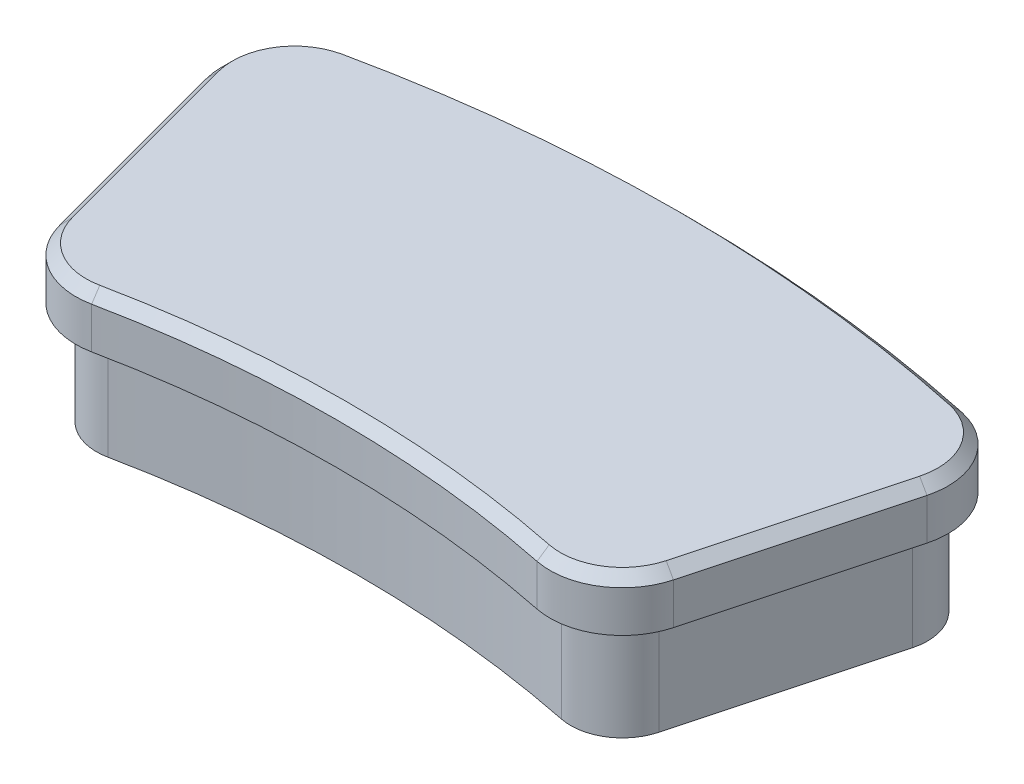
SolidWorks part; units mm, degrees
ref_plane "Front" through (0, 0, 0) normal (0, 0, 1) x (1, 0, 0)
ref_plane "Top" through (0, 0, 0) normal (0, 1, 0) x (1, 0, 0)
ref_plane "Right" through (0, 0, 0) normal (1, 0, 0) x (0, 0, -1)
sketch "Sketch1" plane through (0, 0, 0) normal (0, 1, 0) x (1, 0, 0)
  line L0 (0, 0) -> (-27.9525, 104.32) construction
  line L1 (-27.9525, 104.32) -> (-36.7523, 137.1615)
  line L2 (0, 0) -> (27.9525, 104.32) construction
  line L3 (27.9525, 104.32) -> (36.7523, 137.1615)
  line L4 (0, 0) -> (0, 108) construction
  arc A0 (36.7523, 137.1615) -> (-36.7523, 137.1615) centre (0, 0) ccw
  arc A1 (27.9525, 104.32) -> (-27.9525, 104.32) centre (0, 0) ccw
  dimension "D1" = 284
  dimension "D2" = 216
  dimension "D3" = 30
extrude "Boss-Extrude1" add sketch "Sketch1" along normal blind 15
hole_wizard "M6 Tapped Hole1" positions "Sketch3" profile "Sketch4" tap size "M6" standard "ISO"
sketch "Sketch3" plane through (0, 20, 0) normal (0, 1, 0) x (-1, 0, 0)
  line L0 (0, 0) -> (-20.1432, -114.2377) construction
  line L1 (-20.1432, -114.2377) -> (-23.4425, -132.949) construction
  line L4 (0, 0) -> (20.1432, -114.2377) construction
  line L5 (20.1432, -114.2377) -> (23.4425, -132.949) construction
  line L8 (0, 0) -> (0, -116) construction
  circle A0 centre (0, 0) radius 135 construction
  circle A1 centre (0, 0) radius 116 construction
  point P0 (20.1432, -114.2377)
  point P1 (-20.1432, -114.2377)
  point P3 (-23.4425, -132.949)
  point P5 (23.4425, -132.949)
  dimension "D1" = 232
  dimension "D2" = 270
  dimension "D3" = 20
sketch "Sketch4" plane through (-20.1432, 20, -114.2377) normal (1, 0, 0) x (0, 0, 1)
  line L0 (0, 0) -> (0, 20)
  line L1 (0, 20) -> (2.5, 20)
  line L2 (2.5, 20) -> (2.5, 1)
  line L3 (2.5, 1) -> (3.5, 0)
  line L5 (3.5, 0) -> (0, 0)
  line L6 (-2.5, 1) -> (-3.5, 0) construction
  line L11 (0, -6.35) -> (0, 107.95) construction
  dimension "Thru Tap Drill Dia." = 5
  dimension "Thru Tap Drill Depth" = 20
  dimension "Near C'Sink Dia." = 7
  dimension "Near C'Sink Angle" = 90
sketch "Sketch5" plane through (0, 0, 0) normal (0, 1, 0) x (1, 0, 0)
  line L4 (-34.2991, 135.7335) -> (-26.5335, 106.7519)
  line L5 (26.5335, 106.7519) -> (34.2991, 135.7335)
  line L6 (-34.2991, 135.7335) -> (-26.5335, 106.7519)
  line L7 (26.5335, 106.7519) -> (34.2991, 135.7335)
  arc A4 (26.5335, 106.7519) -> (-26.5335, 106.7519) centre (0, 0) ccw
  arc A5 (34.2991, 135.7335) -> (-34.2991, 135.7335) centre (0, 0) ccw
  arc A6 (26.5335, 106.7519) -> (-26.5335, 106.7519) centre (0, 0) ccw
  arc A7 (34.2991, 135.7335) -> (-34.2991, 135.7335) centre (0, 0) ccw
  dimension "D1" = 2
extrude "Cut-Extrude2" cut sketch "Sketch5" along normal blind 10 flip side to cut
fillet "Fillet1" radius 5 4 edges at (-26.5335, 5, -106.7519) (-34.2991, 5, -135.7335) (26.5335, 5, -106.7519) (34.2991, 5, -135.7335)
fillet "Fillet2" radius 7 4 edges at (-27.9525, 12.5, -104.32) (-36.7523, 12.5, -137.1615) (27.9525, 12.5, -104.32) (36.7523, 12.5, -137.1615)
chamfer "Chamfer1" distance 1 angle 45 8 edges at (-34.1015, 15, -135.6923) (0, 15, -142) (34.1015, 15, -135.6923) (32.3013, 15, -120.55) (26.6305, 15, -106.7344) (0, 15, -108) (-26.6305, 15, -106.7344) (-32.3013, 15, -120.55)
